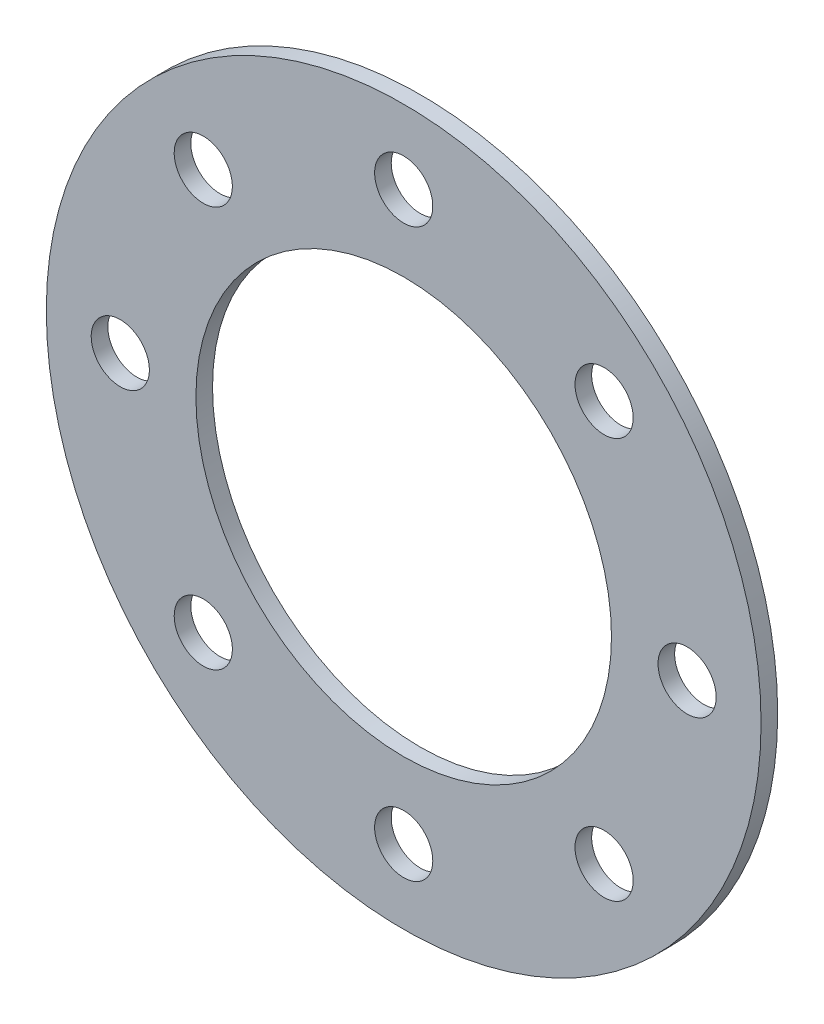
SolidWorks part; units mm, degrees
ref_plane "Alzado" through (0, 0, 0) normal (0, 0, 1) x (1, 0, 0)
ref_plane "Planta" through (0, 0, 0) normal (0, 1, 0) x (1, 0, 0)
ref_plane "Vista lateral" through (0, 0, 0) normal (1, 0, 0) x (0, 0, -1)
sketch "Croquis1" plane through (0, 0, 0) normal (0, 0, 1) x (1, 0, 0)
  line L0 (0, 34.1) -> (0, 0) construction
  circle A0 centre (0, 0) radius 25
  circle A1 centre (0, 0) radius 43
  dimension "D1" = 50
  dimension "D2" = 86
  dimension "D3" = 34.1
  dimension "D5" = 0
extrude "Saliente-Extruir1" add sketch "Croquis1" along normal blind 2
sketch "Croquis2" plane through (0, 0, 0) normal (0, 0, -1) x (-1, 0, 0)
  line L0 (0, 34.1) -> (0, 0) construction
  circle A0 centre (0, 34.1) radius 3.5
  point P6 (-11.8119, 26.8574)
  dimension "D1" = 7
  dimension "D2" = 34.1
  dimension "D3" = 0
extrude "Cortar-Extruir1" cut sketch "Croquis2" against normal blind 2
pattern_circular "MatrizC1" count 8 over 360 about axis through (0, 0, 0) along (0, 0, 1) of "Cortar-Extruir1"
